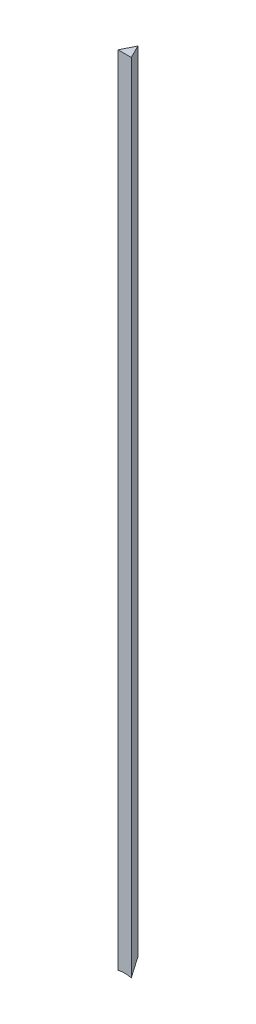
SolidWorks part; units mm, degrees
ref_plane "Ebene vorne" through (0, 0, 0) normal (0, 0, 1) x (1, 0, 0)
ref_plane "Ebene oben" through (0, 0, 0) normal (0, 1, 0) x (1, 0, 0)
ref_plane "Ebene rechts" through (0, 0, 0) normal (1, 0, 0) x (0, 0, -1)
sketch "Skizze1" plane through (0, 0, 0) normal (0, 1, 0) x (1, 0, 0)
  line L0 (0, 0) -> (-6.693, -13.424)
  line L1 (0, 0) -> (6.693, -13.424)
  line L2 (0, 0) -> (0, -39.0522) construction
  line L3 (-6.693, -13.424) -> (6.693, -13.424)
  dimension "D1" = 53
  dimension "D2" = 26.5
  dimension "D3" = 15
  dimension "D4" = 15
extrude "Aufsatz-Linear austragen1" add sketch "Skizze1" along normal blind 838.1
sketch "Skizze2" plane through (607.6532, -269.213, -683.9253) normal (-0.0845, 0.4897, -0.8678) x (-0.6503, -0.687, -0.3243)
  circle A0 centre (-11.6347, 860.7698) radius 31.5
extrude "Schnitt-Linear austragen1" cut sketch "Skizze2" against normal through all
